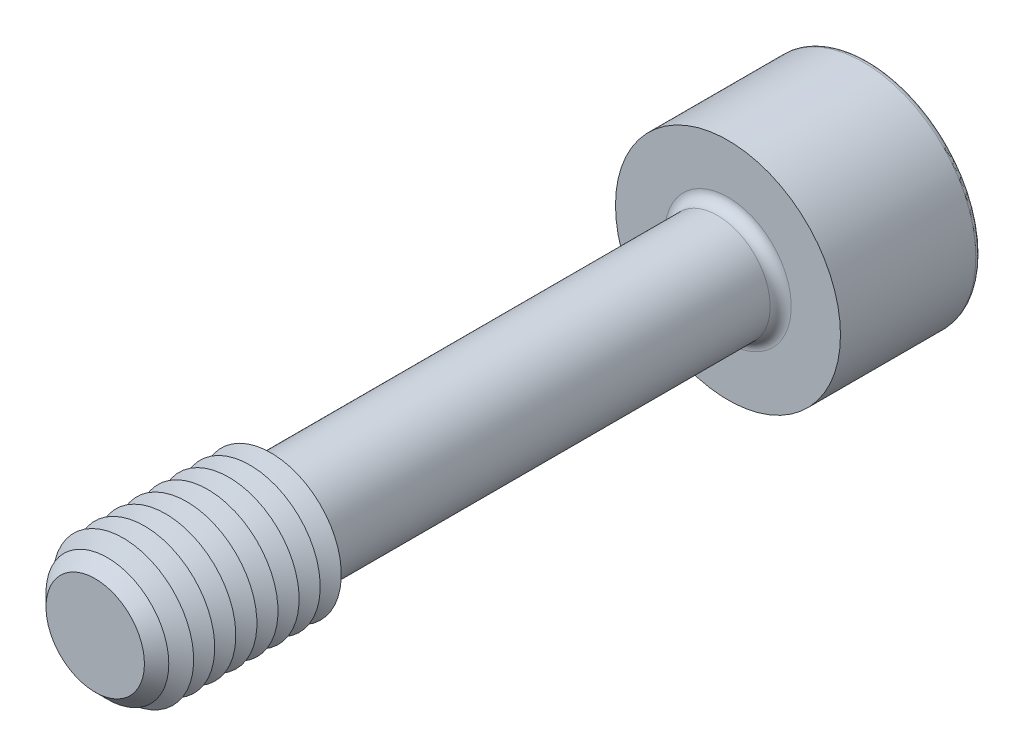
SolidWorks part; units mm, degrees
ref_plane "Front Plane" through (0, 0, 0) normal (0, 0, 1) x (1, 0, 0)
ref_plane "Top Plane" through (0, 0, 0) normal (0, 1, 0) x (1, 0, 0)
ref_plane "Right Plane" through (0, 0, 0) normal (1, 0, 0) x (0, 0, -1)
sketch "Sketch1" plane through (0, 0, 0) normal (0, 0, 1) x (1, 0, 0)
  circle A0 centre (0, 0) radius 3.75
  dimension "D1" = 7.5
extrude "Extrude1" add sketch "Sketch1" along normal mid plane 45
sketch "Sketch2" plane through (0, 0, 0) normal (1, 0, 0) x (0, 0, -1)
  line L0 (-22.5, 0) -> (-22.5, 5)
  line L1 (-22.5, 3.75) -> (-22.5, -3.75) construction
  line L2 (-22.5, 5) -> (-10, 5)
  line L3 (-10, 5) -> (-9.2783, 3.75)
  line L4 (22.5, 3.75) -> (-22.5, 3.75) construction
  line L5 (-9.2783, 3.75) -> (-9.2783, 0)
  line L6 (-9.2783, 0) -> (-22.5, 0)
  dimension "D1" = 5
  dimension "D2" = 120
  dimension "D3" = 12.5
revolve "Revolve1" add sketch "Sketch2" angle 360 about L6
chamfer "Chamfer1" distance 1.5 angle 45 1 edges at (0, 5, 22.5)
sketch "Sketch3" plane through (0, 0, -22.5) normal (0, 0, -1) x (-1, 0, 0)
  circle A0 centre (0, 0) radius 8
  dimension "D1" = 16
extrude "Extrude2" add sketch "Sketch3" along normal blind 10
sketch "Sketch4" plane through (-13.7, 0, -32.5) normal (0, 0, 1) x (1, 0, 0)
  line L2 (11.3906, -4) -> (16.0094, -4)
  line L3 (16.0094, -4) -> (18.3188, 0)
  line L4 (18.3188, 0) -> (16.0094, 4)
  line L6 (16.0094, 4) -> (11.3906, 4)
  line L7 (11.3906, 4) -> (9.0812, 0)
  line L8 (9.0812, 0) -> (11.3906, -4)
  circle A0 centre (13.7, 0) radius 4 construction
  dimension "D1" = 8
extrude "Extrude3" cut sketch "Sketch4" along normal blind 8
fillet "Fillet1" radius 0.75 1 edges at (-3.75, 0, -22.5)
fillet "Fillet2" radius 0.375 1 edges at (-8, 0, -32.5)
sketch "Sketch5" plane through (0, 0, 0) normal (1, 0, 0) x (0, 0, -1)
  line L0 (24.5, 0) -> (24.5, -4)
  line L1 (24.5, -4) -> (22.1906, 0)
  line L2 (22.1906, 0) -> (24.5, 0)
  dimension "D1" = 30
revolve "Cut-Revolve1" cut sketch "Sketch5" angle 360 about L2
sketch "Sketch6" plane through (0, 0, 0) normal (1, 0, 0) x (0, 0, -1)
  line L0 (1.332, 0) -> (-13.289, 0) construction
sketch "Sketch7" plane through (0, 0, 0) normal (1, 0, 0) x (0, 0, -1)
  line L0 (-10, 5) -> (-10.75, 3.701)
  line L1 (-10.75, 3.701) -> (-11.5, 5)
  line L2 (-10, 5) -> (-21, 5) construction
  line L3 (-11.5, 5) -> (-10, 5)
  dimension "D1" = 1.5
revolve "Cut-Revolve2" cut sketch "Sketch7" angle 360 about L0
pattern_linear "LPattern1" count 8 spacing 1.5 along (0, 0, 1) of "Cut-Revolve2"
